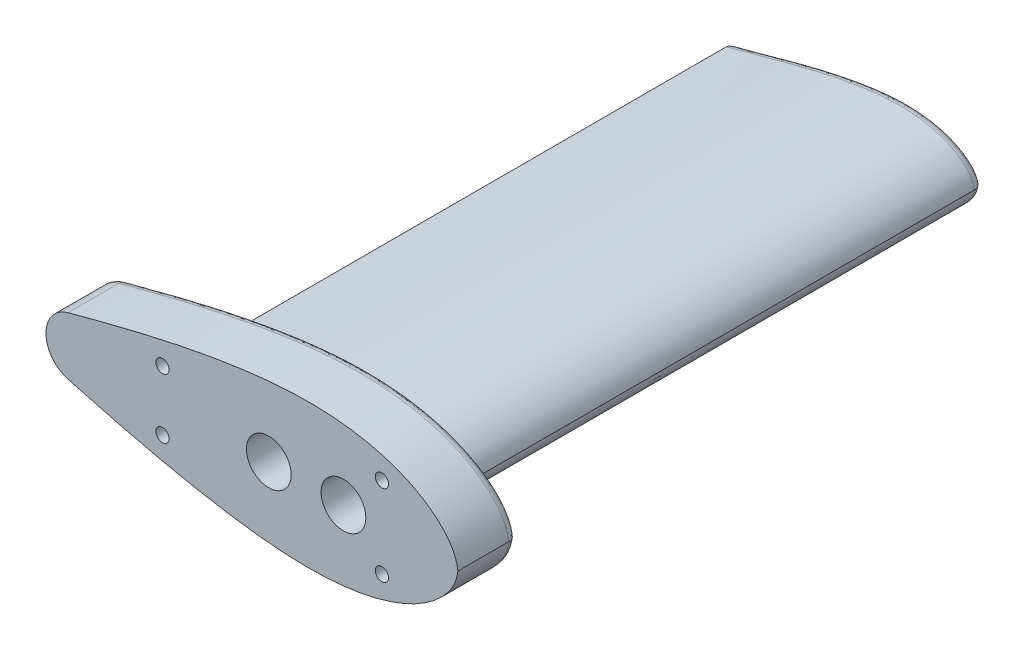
SolidWorks part; units mm, degrees
ref_plane "Front Plane" through (0, 0, 0) normal (0, 0, 1) x (1, 0, 0)
ref_plane "Top Plane" through (0, 0, 0) normal (0, 1, 0) x (1, 0, 0)
ref_plane "Right Plane" through (0, 0, 0) normal (1, 0, 0) x (0, 0, -1)
sketch "Sketch4" plane through (0, 0, 0) normal (0, 0, 1) x (1, 0, 0)
  line L0 (0, 0) -> (-177.8, 0) construction
  arc A0 (-165.8206, -12.2592) -> (-165.8206, 12.2592) centre (-162.5037, 0) cw
  spline S0 degree 3 poles (0, 0) (-0.6675, 6.3742) (-10.0565, 17.9766) (-31.756, 27.884) (-61.5903, 31.8485) (-98.8384, 28.243) (-134.5695, 20.5605) (-157.633, 14.4744) (-165.8206, 12.2592) knots 0 0 0 0 0.081715 0.187537 0.308877 0.476605 0.680371 0.792645 0.792645 0.792645 0.792645
  spline S1 degree 3 poles (0, 0) (-0.6675, -6.3742) (-10.0565, -17.9766) (-31.756, -27.884) (-61.5903, -31.8485) (-98.8384, -28.243) (-134.5695, -20.5605) (-157.633, -14.4744) (-165.8206, -12.2592) knots 0 0 0 0 0.081715 0.187537 0.308877 0.476605 0.680371 0.792645 0.792645 0.792645 0.792645
  dimension "D1" = 12.7
extrude "Boss-Extrude3" add sketch "Sketch4" along normal blind 25.4
sketch "Sketch5" plane through (0, 0, 0) normal (0, 0, -1) x (-1, 0, 0)
  line L0 (0, 0) -> (211.1375, 0) construction
  spline S2 degree 3 poles (30.5264, 0) (30.8599, 3.1852) (35.5516, 8.9829) (46.3949, 13.9336) (61.3027, 15.9147) (91.987, 12.944) (116.9576, 4.9226) (136.0316, 0) knots 0 0 0 0 0.081723 0.187554 0.308904 0.476646 1 1 1 1
  spline S3 degree 3 poles (136.0316, 0) (116.9576, -4.9226) (91.987, -12.944) (61.3027, -15.9147) (46.3949, -13.9336) (35.5516, -8.9829) (30.8599, -3.1852) (30.5264, 0) knots 0 0 0 0 0.523354 0.691096 0.812446 0.918277 1 1 1 1
extrude "Boss-Extrude4" add sketch "Sketch5" along normal blind 228.6
hole_wizard "CBORE for #10 Socket Head Cap Screw1" positions "Sketch12" profile "Sketch13" counterbore size "#10" standard "ANSI Inch"
sketch "Sketch12" plane through (0, 0, 0) normal (0, 0, -1) x (-1, 0, 0)
  line L0 (0, 0) -> (211.1375, 0) construction
  point P0 (32.3086, 17.272)
  point P4 (125.6318, 12.7)
  point P6 (125.6318, -12.7)
  point P10 (32.3086, -17.272)
  dimension "D1" = 12.7
  dimension "D3" = 17.272
sketch "Sketch13" plane through (-32.3086, 17.272, 0) normal (1, 0, 0) x (0, 1, 0)
  line L0 (0, 0) -> (0, 25.4)
  line L1 (0, 25.4) -> (2.8067, 25.4)
  line L3 (2.8067, 25.4) -> (2.8067, 4.826)
  line L4 (4.7625, 4.826) -> (2.8067, 4.826)
  line L5 (4.7625, 4.826) -> (4.7625, 0.635)
  line L6 (4.7625, 0.635) -> (5.3975, 0)
  line L7 (5.3975, 0) -> (0, 0)
  line L8 (-4.7625, 0.635) -> (-5.3975, 0) construction
  line L11 (0, -6.35) -> (0, 107.95) construction
  dimension "Thru Hole Dia." = 5.6134
  dimension "Thru Hole Depth" = 25.4
  dimension "C'Bore Dia." = 9.525
  dimension "C'Bore Depth" = 4.826
  dimension "Near C'Sink Dia." = 10.795
  dimension "Near C'Sink Angle" = 90
fillet "Fillet1" radius 3.81 2 edges
fillet "Fillet2" radius 3.81 3 edges at (-175.2037, 0, 0)
fillet "Fillet3" radius 3.81 2 edges
sketch "Sketch14" plane through (0, 0, -228.6) normal (0, 0, -1) x (-1, 0, 0)
  line L0 (121.3424, 0) -> (34.3738, 0) construction
  circle A0 centre (48.6688, 0) radius 9.525
  circle A1 centre (80.4188, 0) radius 9.525
  spline S0 degree 3 poles (34.3738, 0) (34.4656, -0.4859) (34.6288, -0.9442) (35.0577, -1.8156) (35.3262, -2.2326) (35.914, -3.0067) (36.2352, -3.3682) (36.9149, -4.0564) (37.2735, -4.3828) (38.0185, -5.0099) (38.4034, -5.3093) (39.1871, -5.8756) (39.5871, -6.1436) (40.8094, -6.9067) (41.6537, -7.361) (43.3906, -8.1808) (44.2832, -8.5461) (46.1083, -9.2031) (47.032, -9.4918) (49.8247, -10.2598) (51.7209, -10.6393) (55.5564, -11.1819) (57.4708, -11.3423) (61.2948, -11.4993) (63.2044, -11.4956) (68.9274, -11.2887) (72.735, -10.8905) (78.4404, -10.086) (80.3398, -9.7847) (84.1221, -9.1295) (86.0069, -8.7748) (91.6453, -7.642) (95.3828, -6.7951) (106.5539, -4.0777) (113.9462, -2.0305) (121.3424, 0) knots 0 0 0 0 0.015625 0.015625 0.03125 0.03125 0.046875 0.046875 0.0625 0.0625 0.078125 0.078125 0.09375 0.09375 0.125 0.125 0.15625 0.15625 0.1875 0.1875 0.25 0.25 0.3125 0.3125 0.375 0.375 0.5 0.5 0.5625 0.5625 0.625 0.625 0.75 0.75 1 1 1 1 construction
  spline S1 degree 3 poles (121.3424, 0) (113.946, 2.0305) (106.5536, 4.0777) (95.3823, 6.7953) (91.6447, 7.6421) (86.0062, 8.7749) (84.1213, 9.1296) (80.339, 9.7849) (78.4395, 10.0862) (72.7341, 10.8906) (68.9264, 11.2888) (63.2033, 11.4956) (61.2937, 11.4993) (57.4696, 11.3422) (55.5551, 11.1818) (51.7196, 10.639) (49.8233, 10.2595) (47.0306, 9.4914) (46.1069, 9.2026) (44.2817, 8.5456) (43.3891, 8.1802) (41.6523, 7.3603) (40.808, 6.9059) (39.5857, 6.1427) (39.1857, 5.8747) (38.4021, 5.3083) (38.0172, 5.0089) (37.2722, 4.3817) (36.9136, 4.0552) (36.2341, 3.3669) (35.9129, 3.0054) (35.3252, 2.2312) (35.0568, 1.814) (34.6283, 0.9429) (34.4656, 0.4861) (34.3738, 0) knots 0 0 0 0 0.25 0.25 0.375 0.375 0.4375 0.4375 0.5 0.5 0.625 0.625 0.6875 0.6875 0.75 0.75 0.8125 0.8125 0.84375 0.84375 0.875 0.875 0.90625 0.90625 0.921875 0.921875 0.9375 0.9375 0.953125 0.953125 0.96875 0.96875 0.984375 0.984375 1 1 1 1 construction
  dimension "D1" = 19.05
  dimension "D2" = 31.75
extrude "Cut-Extrude1" cut sketch "Sketch14" against normal up to next
